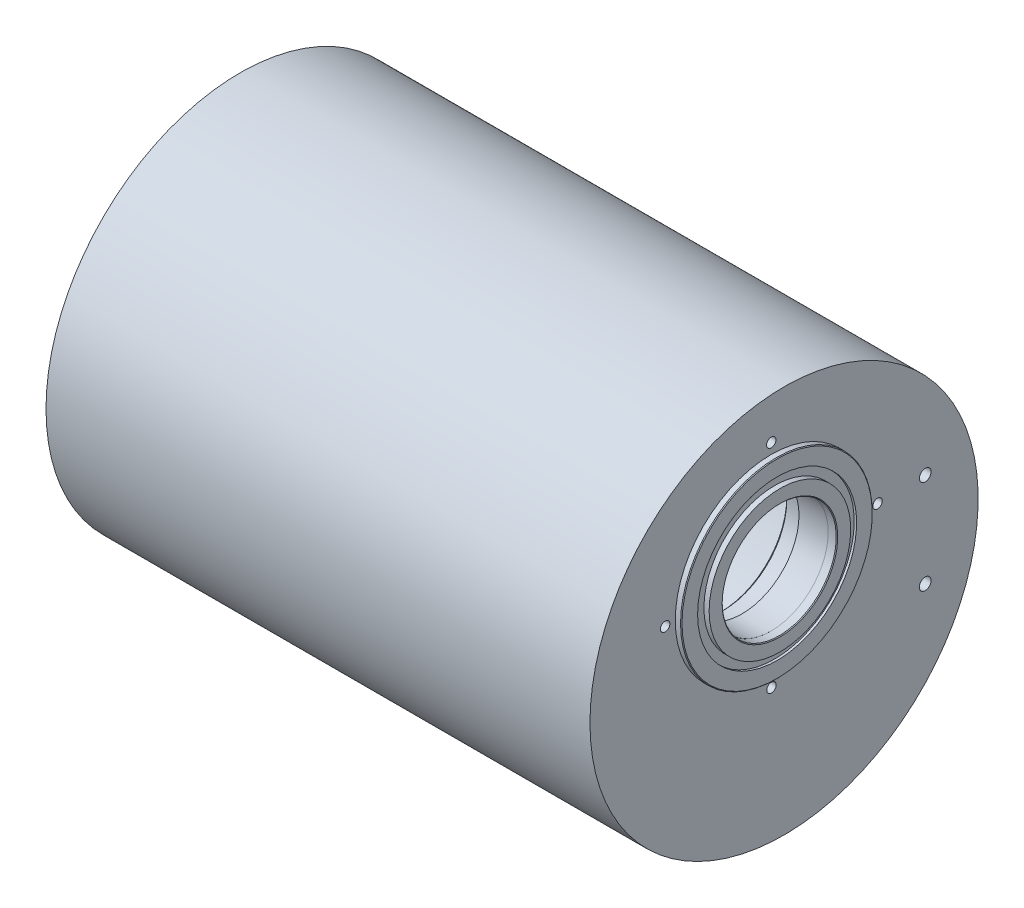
SolidWorks part; units mm, degrees
ref_plane "front" through (0, 0, 0) normal (0, 0, 1) x (1, 0, 0)
ref_plane "top" through (0, 0, 0) normal (0, 1, 0) x (1, 0, 0)
ref_plane "right" through (0, 0, 0) normal (1, 0, 0) x (0, 0, -1)
sketch "Sketch1" plane through (0, 0, 0) normal (0, 0, 1) x (1, 0, 0)
  line L0 (-141.3673, 0) -> (138.218, 0) construction
  line L1 (-192.024, 104.775) -> (-192.024, 94.4372)
  line L2 (-192.024, 94.4372) -> (-172.974, 94.4372)
  line L3 (-192.024, 104.775) -> (101.6, 104.775)
  line L4 (101.6, 104.775) -> (101.6, 0)
  line L5 (101.6, 0) -> (74.0156, 0)
  line L6 (74.0156, 0) -> (74.0156, 92.71)
  line L7 (-172.974, 94.4372) -> (-172.974, 92.71)
  line L8 (-172.974, 92.71) -> (74.0156, 92.71)
  dimension "D1" = 104.775
  dimension "D2" = 94.4372
  dimension "D3" = 92.71
  dimension "D4" = 293.624
  dimension "D5" = 27.5844
  dimension "D6" = 19.05
  dimension "D7" = 101.6
revolve "case" add sketch "Sketch1" angle 360 about L0
sketch "Sketch2" plane through (101.6, 0, 0) normal (1, 0, 0) x (0, 0, -1)
  circle A0 centre (-6.858, 24.892) radius 30.7975
  dimension "D3" = 61.595
  dimension "D1" = 24.892
  dimension "D2" = 6.858
extrude "small window bore" cut sketch "Sketch2" against normal blind 15.875
sketch "Sketch3" plane through (85.725, 0, 0) normal (1, 0, 0) x (0, 0, -1)
  circle A0 centre (-6.858, 24.892) radius 34.29
  dimension "D1" = 68.58
extrude "window large bore" cut sketch "Sketch3" against normal through all
ref_plane ".275 OFFSET" through (0, 0, 6.985) normal (0, 0, 1) x (1, 0, 0)
ref_plane "FACE" through (254, 0, 0) normal (1, 0, 0) x (0, 0, -1)
sketch "Sketch4" plane through (0, 0, 6.985) normal (0, 0, 1) x (1, 0, 0)
  line L0 (101.6, 24.892) -> (367.1873, 24.892) construction
  line L1 (85.725, 24.892) -> (101.6, 24.892) construction
  line L2 (101.6, 55.6895) -> (105.9656, 55.6895)
  line L3 (101.6, -104.775) -> (101.6, 104.775) construction
  line L4 (101.6, 55.6895) -> (85.725, 55.6895) construction
  line L5 (105.9656, 55.6895) -> (106.3625, 56.0864)
  line L6 (106.3625, 56.0864) -> (106.3625, 63.119)
  line L7 (106.3625, 63.119) -> (103.5431, 63.119)
  line L8 (103.5431, 63.119) -> (103.5431, 67.818)
  line L9 (103.5431, 67.818) -> (104.8385, 67.818)
  line L10 (104.8385, 67.818) -> (104.8385, 76.2349)
  line L11 (104.4416, 76.6318) -> (101.6, 76.6318)
  line L12 (101.6, 55.6895) -> (101.6, 76.6318)
  line L13 (104.4416, 76.6318) -> (104.8385, 76.2349)
  dimension "D1" = 135
  dimension "D2" = 0.3969
  dimension "D3" = 4.7625
  dimension "D4" = 1.524
  dimension "D5" = 4.699
  dimension "D6" = 51.7398
  dimension "D7" = 38.227
  dimension "D8" = 2.8194
  dimension "D9" = 135
  dimension "D10" = 0.3969
revolve "Boss-Revolve1" add sketch "Sketch4" angle 360 about L0
fillet "Fillet1" radius 1.5875
chamfer "Chamfer1" distance 1.5875 angle 45
fillet "Fillet4" radius 1.016
ref_plane "Plane1" through (-30.48, 0, 0) normal (1, 0, 0) x (0, 0, -1)
sketch "Sketch7" plane through (-30.48, 0, 0) normal (1, 0, 0) x (0, 0, -1)
  line L0 (0, 0) -> (0, 113.2773) construction
  line L1 (0, 0) -> (-133.5799, 0) construction
  circle A0 centre (0, 113.2773) radius 9.525
  dimension "D1" = 19.05
  dimension "D2" = 113.2773
ref_plane "Plane2" through (-187.96, 0, 0) normal (1, 0, 0) x (0, 0, -1)
sketch "Sketch8" plane through (101.6, 0, 0) normal (1, 0, 0) x (0, 0, -1)
  circle A0 centre (-6.9191, 82.2198) radius 2.54
  dimension "D1" = 5.08
  dimension "D2" = 57.3278
extrude "Cut-Extrude1" cut sketch "Sketch8" against normal blind 9.525
pattern_circular "CirPattern1" count 4 every 90
sketch "Sketch9" plane through (101.6, 0, 0) normal (1, 0, 0) x (0, 0, -1)
  circle A0 centre (76.2, -25.4) radius 3.175
  circle A1 centre (76.2, 25.4) radius 3.175
  dimension "D1" = 6.35
  dimension "D2" = 25.4
  dimension "D3" = 25.4
  dimension "D4" = 76.2
  dimension "D5" = 76.2
extrude "Cut-Extrude2" cut sketch "Sketch9" against normal blind 12.7
